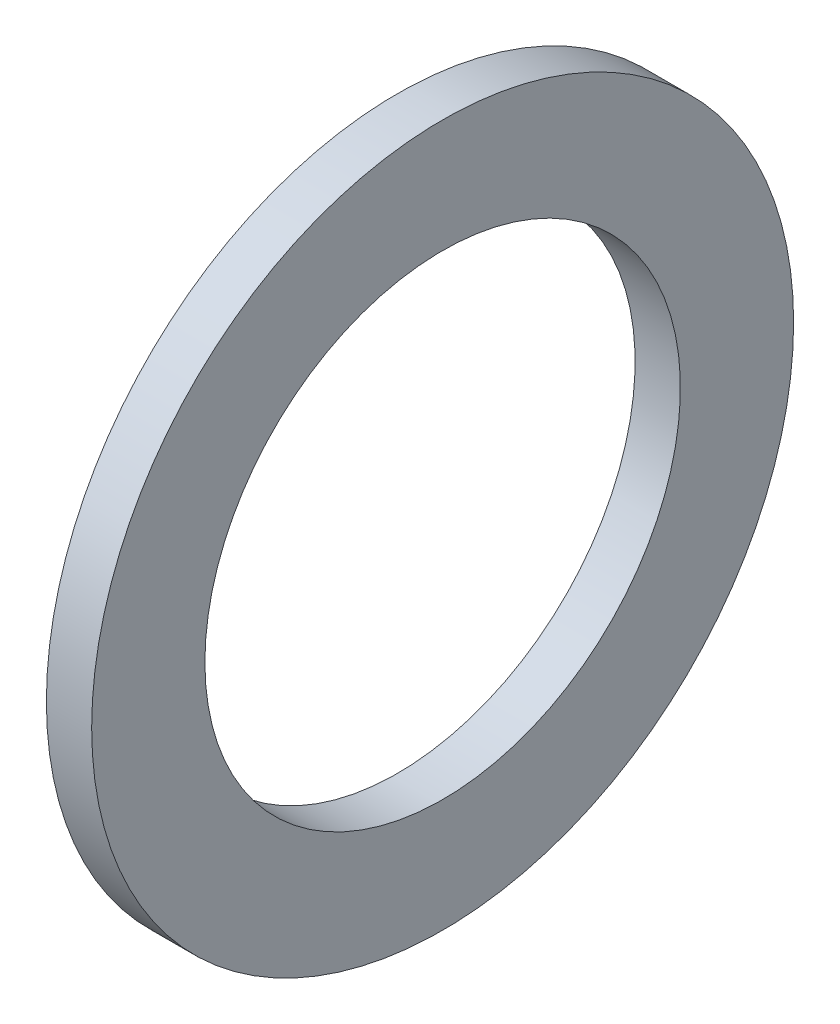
SolidWorks part; units mm, degrees
ref_plane "Plane1" through (0, 0, 0) normal (0, 0, 1) x (1, 0, 0)
ref_plane "Plane2" through (0, 0, 0) normal (0, 1, 0) x (1, 0, 0)
ref_plane "Plane3" through (0, 0, 0) normal (1, 0, 0) x (0, 0, -1)
other "Configuration Table"
sketch "Sketch1" plane through (0, 0, 0) normal (0, 0, 1) x (1, 0, 0)
  line L0 (-34.925, 0) -> (9.525, 0) construction
  line L1 (0, 10.5) -> (0, 15.5)
  line L2 (0, 15.5) -> (-2, 15.5)
  line L3 (-2, 15.5) -> (-2, 10.5)
  line L4 (-2, 10.5) -> (0, 10.5)
  dimension "Thickness" = 2
  dimension "Inside_dia" = 21
  dimension "Outside_dia" = 31
revolve "Base-Revolve" add sketch "Sketch1" angle 360 about L0
